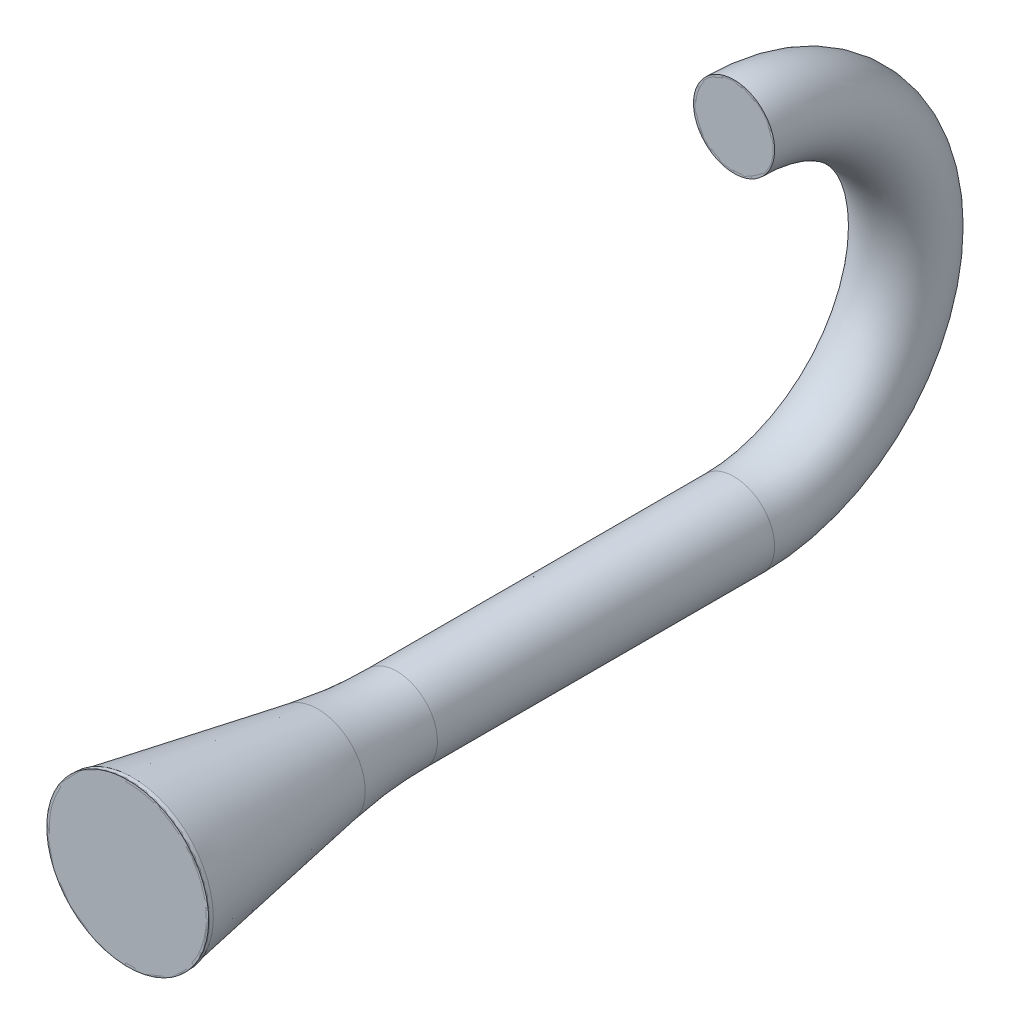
SolidWorks part; units mm, degrees
ref_plane "Front" through (0, 0, 0) normal (0, 0, 1) x (1, 0, 0)
ref_plane "Top" through (0, 0, 0) normal (0, 1, 0) x (1, 0, 0)
ref_plane "Right"
sketch "Sketch1" plane through (0, 0, 0) normal (1, 0, 0) x (0, 0, -1)
  line L0 (0, 59.2726) -> (0, -59.2726) construction
  line L1 (826.6455, 311.0428) -> (47623.5202, 17919.3511) construction
  line L2 (-251.0054, -114.3) -> (0, -114.3)
  arc A0 (0, 114.3) -> (0, -114.3) centre (0, 0) cw
  dimension "D2" = 114.3
sketch "Sketch3" plane through (0, 0, 0) normal (0, 0, 1) x (1, 0, 0)
  circle A0 centre (0, 114.3) radius 25.4
  dimension "D1" = 50.8
ref_plane "Plane1" through (0, -127, 0) normal (0, 1, 0) x (-1, 0, 0)
sweep "Sweep1" add profiles "Sketch3" path "Sketch1"
sketch "Sketch9" plane through (0, 0, 251.0054) normal (0, 0, 1) x (1, 0, 0)
  circle A0 centre (0, -114.3) radius 25.4
extrude "Extrude3" add sketch "Sketch9" along normal blind 152.4 draft 10
fillet "Fillet2" radius 304.8 1 edges at (25.4, -114.3, 251.0054)
shell "Shell4" thickness 1.5875
sketch "Sketch10" plane through (0, 0, 0) normal (0, 0, 1) x (1, 0, 0)
  line L0 (-15.6576, -94.3) -> (15.6576, -94.3)
  circle A0 centre (0, -114.3) radius 25.4 construction
  arc A1 (-15.6576, -94.3) -> (15.6576, -94.3) centre (0, -114.3) ccw
  dimension "D1" = 20
extrude "Boss-Extrude1" add sketch "Sketch10" along normal blind 10
sketch3d "3DSketch1"
  circle A0 centre (0, -114.3, 224.3389) radius 26.9875 construction
  point P0 (0, -114.3, 224.3389)
  point P4 (0, -114.3, 197.3514)
ref_plane "Plane2" through (0, 0, 224.3389) normal (0, 0, 1) x (1, 0, 0)
sketch "Sketch11" plane through (0, 0, 224.3389) normal (0, 0, 1) x (1, 0, 0)
  line L0 (-25.4, -114.3) -> (25.4, -114.3)
  circle A0 centre (0, -114.3) radius 25.4 construction
  arc A1 (25.4, -114.3) -> (-25.4, -114.3) centre (0, -114.3) ccw
extrude "Boss-Extrude2" add sketch "Sketch11" against normal blind 3
imported_body "LID1"
imported_body "LID2"
